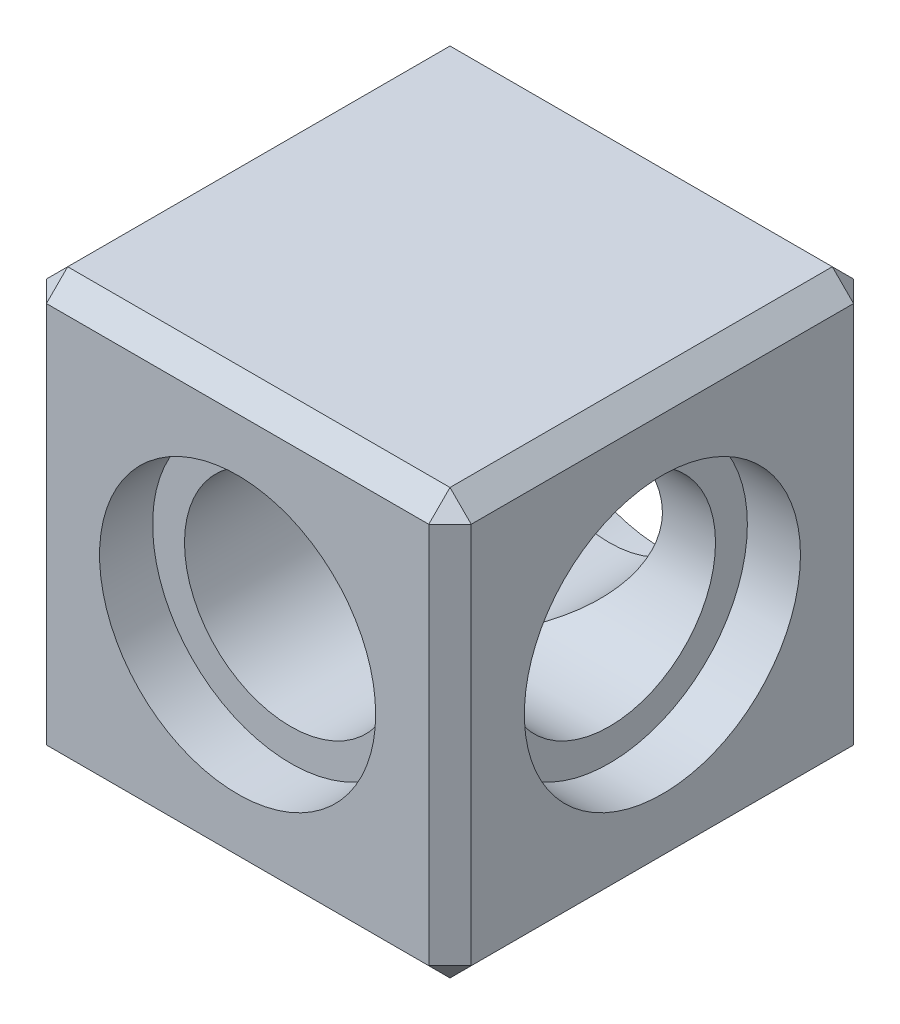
SolidWorks part; units mm, degrees
ref_plane "Płaszczyzna przednia" through (0, 0, 0) normal (0, 0, 1) x (1, 0, 0)
ref_plane "Płaszczyzna górna" through (0, 0, 0) normal (0, 1, 0) x (1, 0, 0)
ref_plane "Płaszczyzna prawa" through (0, 0, 0) normal (1, 0, 0) x (0, 0, -1)
sketch "Szkic1" plane through (0, 0, 0) normal (0, 0, 1) x (1, 0, 0)
  line L1 (20, -20) -> (-20, -20)
  line L2 (20, -20) -> (20, 20)
  line L3 (20, 20) -> (-20, 20)
  line L4 (-20, -20) -> (-20, 20)
  line L5 (20, -20) -> (-20, 20) construction
  line L6 (20, 20) -> (-20, -20) construction
  point P0 (0, 0)
  dimension "D1" = 40
  dimension "D2" = 40
extrude "Dodanie-wyciągnięcie1" add sketch "Szkic1" along normal mid plane 40
sketch "Szkic2" plane through (0, 0, 20) normal (0, 0, 1) x (1, 0, 0)
  circle A0 centre (0, 0) radius 10
  dimension "D1" = 20
extrude "Wytnij-wyciągnięcie1" cut sketch "Szkic2" against normal through all
sketch "Szkic3" plane through (20, 0, 0) normal (1, 0, 0) x (0, 0, -1)
  circle A0 centre (0, 0) radius 10
  dimension "D1" = 20
extrude "Wytnij-wyciągnięcie2" cut sketch "Szkic3" against normal up to next
sketch "Szkic4" plane through (0, 0, 20) normal (0, 0, 1) x (1, 0, 0)
  circle A0 centre (0, 0) radius 13
  dimension "D1" = 26
extrude "Wytnij-wyciągnięcie3" cut sketch "Szkic4" against normal blind 5
mirror "Lustro1" about plane through (0, 0, 0) normal (0, 0, 1) of "Wytnij-wyciągnięcie3"
sketch "Szkic5" plane through (20, 0, 0) normal (1, 0, 0) x (0, 0, -1)
  circle A0 centre (0, 0) radius 13
  dimension "D1" = 26
extrude "Wytnij-wyciągnięcie4" cut sketch "Szkic5" against normal blind 5
chamfer "Sfazowanie1" distance 2 angle 45 12 edges at (-20, -20, 0) (0, -20, 20) (20, -20, 0) (0, -20, -20) (20, 20, 0) (20, 0, -20) (0, 20, -20) (-20, 0, -20) (-20, 20, 0) (-20, 0, 20) (0, 20, 20) (20, 0, 20)
